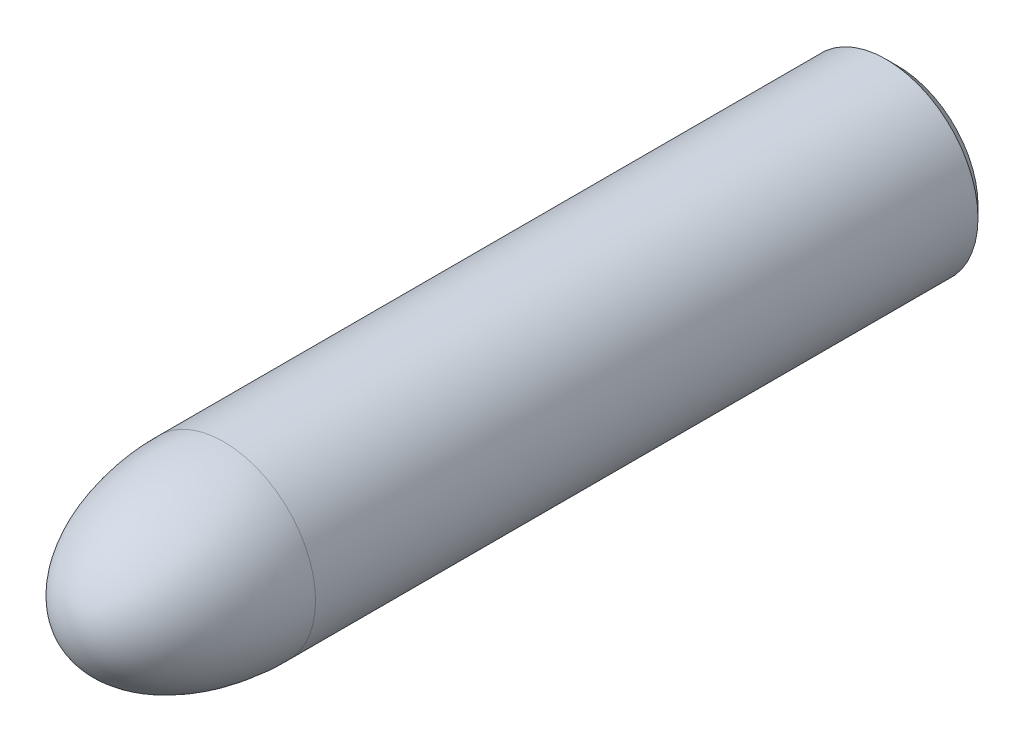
SolidWorks part; units mm, degrees
ref_plane "Спереди" through (0, 0, 0) normal (0, 0, 1) x (1, 0, 0)
ref_plane "Сверху" through (0, 0, 0) normal (0, 1, 0) x (1, 0, 0)
ref_plane "Справа" through (0, 0, 0) normal (1, 0, 0) x (0, 0, -1)
sketch "Эскиз1" plane through (0, 0, 0) normal (1, 0, 0) x (0, 0, -1)
  line L0 (0, 0) -> (53.6182, 0) construction
  line L1 (3.3175, 2) -> (18, 2)
  line L2 (18, 2) -> (18, 0)
  line L3 (18, 0) -> (0, 0)
  ellipse E0 centre (3.3175, 0) end of major axis (6.635, 0) minor radius 2 (3.3175, 2) -> (0, 0) ccw
  dimension "D1" = 6.635
  dimension "D2" = 4
  dimension "D3" = 18
revolve "Повернуть1" add sketch "Эскиз1" angle 360 about L0
chamfer "Фаска1" distance 0.25 angle 45 1 edges at (2, 0, -18)
